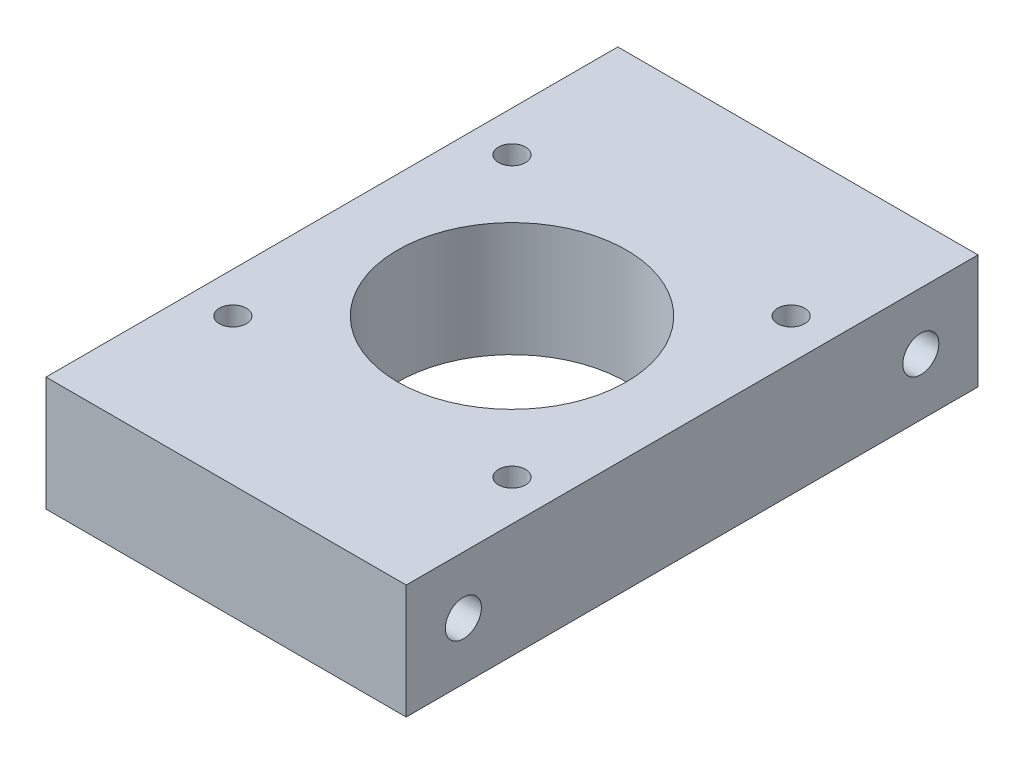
SolidWorks part; units mm, degrees
ref_plane "Front Plane" through (0, 0, 0) normal (0, 0, 1) x (1, 0, 0)
ref_plane "Top Plane" through (0, 0, 0) normal (0, 1, 0) x (1, 0, 0)
ref_plane "Right Plane" through (0, 0, 0) normal (1, 0, 0) x (0, 0, -1)
sketch "Sketch1" plane through (0, 0, 0) normal (0, 1, 0) x (1, 0, 0)
  line L1 (-42.4065, 18.0777) -> (-2.4065, 18.0777)
  line L2 (-42.4065, 18.0777) -> (-42.4065, -45.4223)
  line L3 (-42.4065, -45.4223) -> (-2.4065, -45.4223)
  line L4 (-2.4065, 18.0777) -> (-2.4065, -45.4223)
  dimension "D1" = 40
  dimension "D2" = 63.5
extrude "Boss-Extrude1" add sketch "Sketch1" along normal blind 12.7
sketch "Sketch2" plane through (-2.4065, 0, 0) normal (1, 0, 0) x (0, 0, -1)
  line L0 (-45.4223, 12.7) -> (-45.4223, 0) construction
  line L1 (-45.4223, 0) -> (18.0777, 0) construction
  line L2 (18.0777, 12.7) -> (18.0777, 0) construction
  line L3 (-45.4223, 12.7) -> (18.0777, 12.7) construction
  circle A0 centre (-39.0723, 6.35) radius 2
  circle A1 centre (11.7277, 6.35) radius 2
  dimension "D5" = 4
  dimension "D6" = 4
  dimension "D1" = 6.35
  dimension "D2" = 6.35
  dimension "D3" = 6.35
  dimension "D4" = 6.35
extrude "Cut-Extrude1" cut sketch "Sketch2" against normal blind 25.4
sketch "Sketch3" plane through (0, 12.7, 0) normal (0, 1, 0) x (1, 0, 0)
  line L0 (-2.4065, 18.0777) -> (-42.4065, 18.0777) construction
  line L1 (-42.4065, 18.0777) -> (-42.4065, -45.4223) construction
  circle A0 centre (-22.4065, -13.6723) radius 12.7
  dimension "D3" = 25.4
  dimension "D1" = 31.75
  dimension "D2" = 20
extrude "Cut-Extrude2" cut sketch "Sketch3" against normal through all
sketch "Sketch4" plane through (0, 12.7, 0) normal (0, 1, 0) x (1, 0, 0)
  circle A0 centre (-37.9065, 1.8277) radius 1.5
  circle A1 centre (-6.9065, 1.8277) radius 1.5
  circle A2 centre (-6.9065, -29.1723) radius 1.5
  circle A3 centre (-37.9065, -29.1723) radius 1.5
  point P2 (-22.4065, -13.6723)
  dimension "D1" = 3
  dimension "D2" = 15.5
  dimension "D3" = 15.5
  dimension "D4" = 4
extrude "Cut-Extrude3" cut sketch "Sketch4" against normal through all
